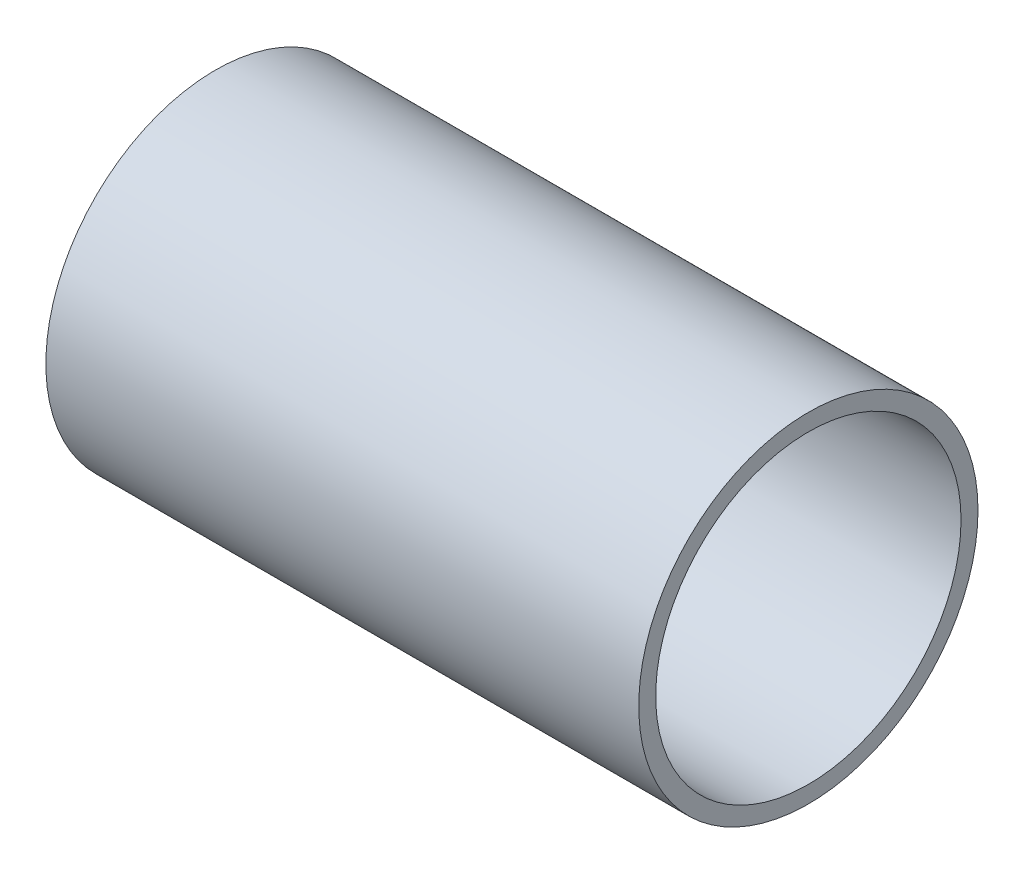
SolidWorks part; units mm, degrees
ref_plane "Plan de face" through (0, 0, 0) normal (0, 0, 1) x (1, 0, 0)
ref_plane "Plan de dessus" through (0, 0, 0) normal (0, 1, 0) x (1, 0, 0)
ref_plane "Plan de droite" through (0, 0, 0) normal (1, 0, 0) x (0, 0, -1)
sketch "Esquisse1" plane through (0, 0, 0) normal (0, 0, 1) x (1, 0, 0)
  line L0 (-34.95, 20) -> (-34.95, 18)
  line L1 (-34.95, 18) -> (34.95, 18)
  line L2 (34.95, 18) -> (34.95, 20)
  line L3 (34.95, 20) -> (-34.95, 20)
  line L4 (-34.95, 0) -> (34.95, 0) construction
revolve "Révolution1" add sketch "Esquisse1" angle 360 about L4
